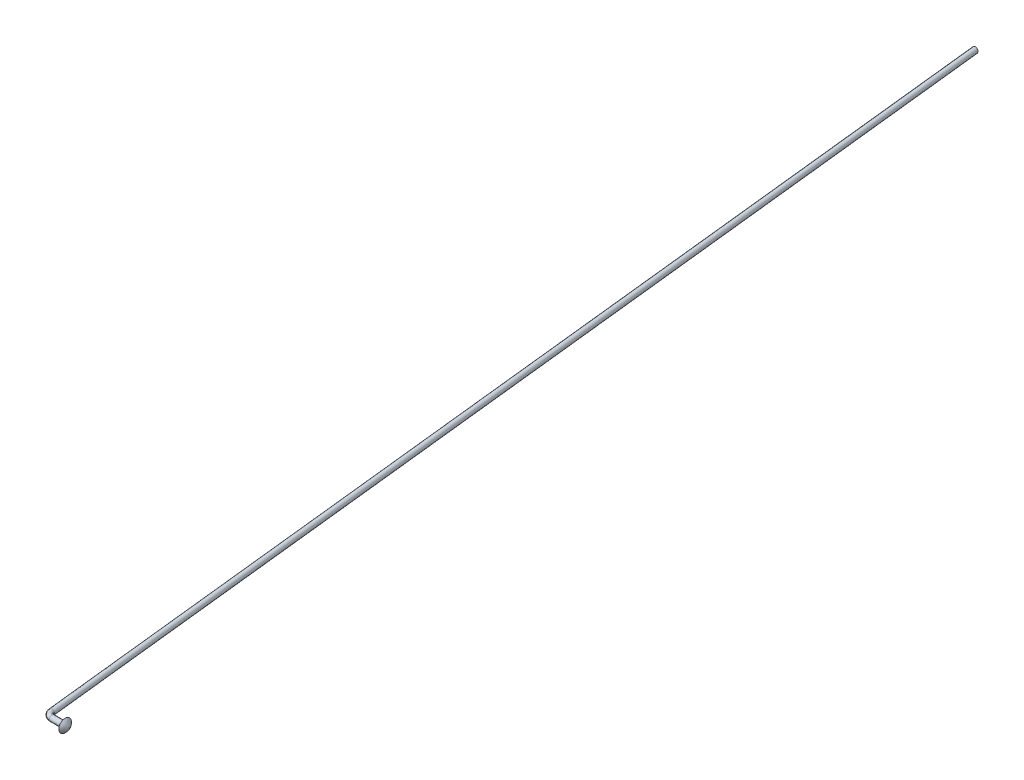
SolidWorks part; units mm, degrees
ref_plane "Front Plane" through (0, 0, 0) normal (0, 0, 1) x (1, 0, 0)
ref_plane "Top Plane" through (0, 0, 0) normal (0, 1, 0) x (1, 0, 0)
ref_plane "Right Plane" through (0, 0, 0) normal (1, 0, 0) x (0, 0, -1)
ref_plane "Plane1" through (0, 0, 4.5) normal (0, 0, 1) x (1, 0, 0)
sketch "spita" plane through (0, 0, 0) normal (0, 1, 0) x (1, 0, 0)
  line L0 (-0.7339, -277.9826) -> (-30.7, 0)
  line L1 (4.2278, -279.3291) -> (0.7583, -279.3291)
  line L2 (5.0134, -279.3291) -> (2.0134, -279.3291) construction
  line L3 (-30.7, -200.1597) -> (-30.7, 0) construction
  line L5 (-30.7, 0) -> (-30.7, -5.8165) construction
  arc A0 (-0.7339, -277.9826) -> (0.7583, -279.3291) centre (0.7583, -277.8291) ccw
  dimension "D1" = 1.5
  dimension "D2" = 3.4696
  dimension "D3" = 30.7
sketch "Sketch2" plane through (0, 0, 0) normal (0, 0, 1) x (1, 0, 0)
  line L0 (-0.7339, 0) -> (-30.7, 0) construction
  circle A0 centre (-30.7, 0) radius 0.75
  dimension "D1" = 1.5
  dimension "D2" = 30.7
sweep "spitza" add profiles "Sketch2" path "spita"
sketch "Sketch3" plane through (0, 0, 0) normal (0, 1, 0) x (1, 0, 0)
  line L0 (4.2278, -279.3291) -> (4.2278, -277.6291)
  line L2 (4.2278, -279.3291) -> (5.2278, -279.3291)
  arc A0 (4.2278, -277.6291) -> (5.2278, -279.3291) centre (2.2857, -279.9156) cw
  dimension "D1" = 3
  dimension "D2" = 1.7
  dimension "D3" = 1
revolve "cap spita" add sketch "Sketch3" angle 360 about L2
